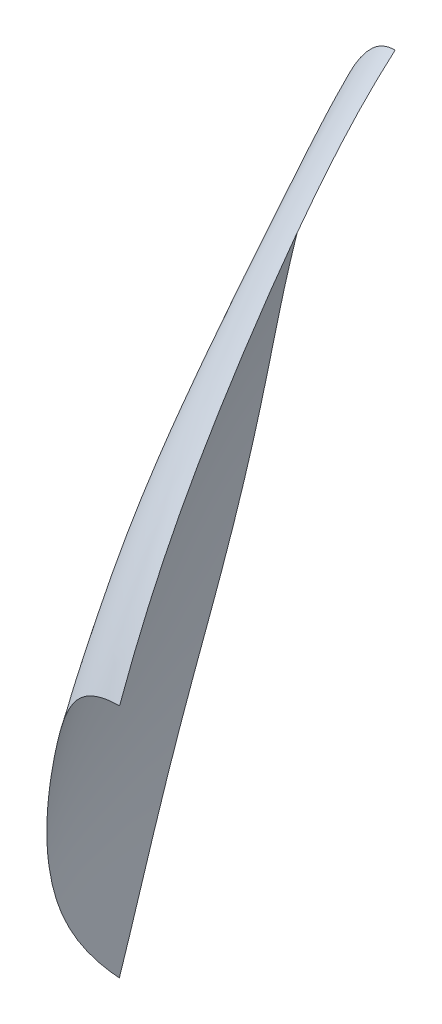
SolidWorks part; units mm, degrees
ref_plane "Ebene vorne" through (0, 0, 0) normal (0, 0, 1) x (1, 0, 0)
ref_plane "Ebene oben" through (0, 0, 0) normal (0, 1, 0) x (1, 0, 0)
ref_plane "Ebene rechts" through (0, 0, 0) normal (1, 0, 0) x (0, 0, -1)
surface "Surface-Offset1" parameters "D1"=0
